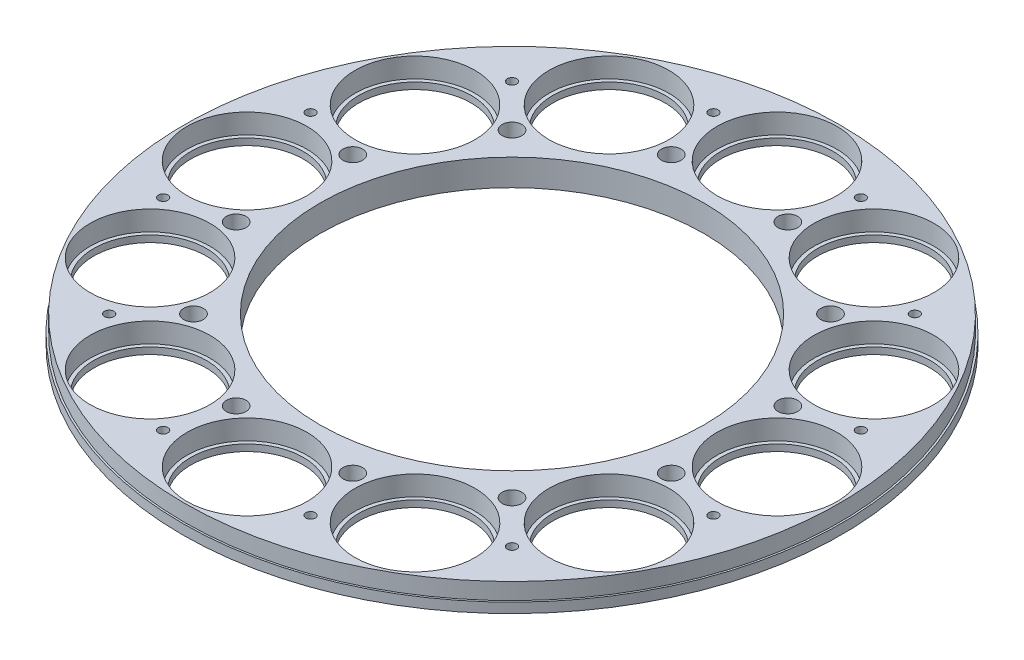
SolidWorks part; units mm, degrees
ref_plane "Front" through (0, 0, 0) normal (0, 0, 1) x (1, 0, 0)
ref_plane "Top" through (0, 0, 0) normal (0, 1, 0) x (1, 0, 0)
ref_plane "Right" through (0, 0, 0) normal (1, 0, 0) x (0, 0, -1)
ref_axis "Axis1" through (0, 50, 0) along (0, -1, 0)
sketch "Sketch1" plane through (0, 0, 0) normal (0, 1, 0) x (1, 0, 0)
  circle A0 centre (0, 0) radius 157.9562
  dimension "D1" = 315.9125
extrude "Boss-Extrude1" add sketch "Sketch1" along normal blind 12.7
sketch "Sketch2" plane through (0, 12.7, 0) normal (0, 1, 0) x (1, 0, 0)
  circle A0 centre (0, 127) radius 28.7655
  dimension "D2" = 57.531
  dimension "D1" = 127
extrude "Cut-Extrude1" cut sketch "Sketch2" against normal offset from surface (9.525 mm away) 3.175
sketch "Sketch3" plane through (0, 3.175, 0) normal (0, 1, 0) x (1, 0, 0)
  circle A0 centre (0, 127) radius 26.9875
  circle A2 centre (0, 127) radius 28.7655 construction
  circle A3 centre (0, 127) radius 28.7655 construction
  dimension "D1" = 1.778
  dimension "D2" = 53.975
extrude "Cut-Extrude2" cut sketch "Sketch3" against normal through all
pattern_circular "CirPattern1" count 12 over 360 about axis through (0, 0, 0) along (0, 1, 0) of "Cut-Extrude1", "Cut-Extrude2"
sketch "Sketch4" plane through (0, 12.7, 0) normal (0, 1, 0) x (1, 0, 0)
  line L0 (0, 92.075) -> (0, 0) construction
  line L1 (0, 92.075) -> (0, 98.2345) construction
  circle A0 centre (0, 0) radius 92.075
  circle A3 centre (0, 127) radius 28.7655 construction
  dimension "D1" = 184.15
extrude "Cut-Extrude3" cut sketch "Sketch4" against normal through all
sketch "Sketch5" plane through (0, 0, 0) normal (0, 0, 1) x (1, 0, 0)
  line L1 (157.9562, 12.7) -> (157.0673, 12.7)
  line L2 (157.9562, 12.7) -> (157.9562, 4.7625)
  line L3 (157.9562, 4.7625) -> (157.0673, 4.7625)
  line L4 (157.0673, 12.7) -> (157.0673, 4.7625)
  dimension "D1" = 0.889
  dimension "D2" = 7.9375
revolve "Cut-Revolve1" cut sketch "Sketch5" angle 360 about axis through (0, 50, 0) along (0, -1, 0)
hole_wizard "CSK for M4 Flat Head Machine Screw1" positions "Sketch8" profile "Sketch9" countersink size "M4" standard "ANSI Metric"
sketch "Sketch8" plane through (0, 12.7, 0) normal (0, 1, 0) x (1, 0, 0)
  line L0 (0, 0) -> (0, 92.075) construction
  line L3 (27.9395, 104.2717) -> (0, 0) construction
  circle A0 centre (0, 0) radius 92.075 construction
  point P0 (27.9395, 104.2717)
  dimension "D1" = 15
  dimension "D2" = 107.95
sketch "Sketch9" plane through (27.9395, 12.7, -104.2717) normal (1, 0, 0) x (0, 0, 1)
  line L0 (0, 0) -> (0, 12.7)
  line L1 (0, 12.7) -> (2.25, 12.7)
  line L2 (2.25, 12.7) -> (2.25, 10.45)
  line L3 (2.25, 10.45) -> (4.7, 8)
  line L4 (4.7, 8) -> (4.7, 0)
  line L6 (4.7, 0) -> (0, 0)
  line L7 (-2.25, 10.45) -> (-4.7, 8) construction
  line L11 (0, -6.35) -> (0, 107.95) construction
  dimension "Thru Hole Dia." = 4.5
  dimension "Thru Hole Depth" = 12.7
  dimension "C'Sink Dia." = 9.4
  dimension "C'Sink Angle" = 90
  dimension "Head Clearance" = 8
pattern_circular "CirPattern2" count 12 over 360 about axis through (0, 0, 0) along (0, 1, 0) of "CSK for M4 Flat Head Machine Screw1"
sketch "Sketch11" plane through (0, 0, 0) normal (0, 1, 0) x (1, 0, 0)
  line L0 (44.9013, 71.842) -> (66.8214, 73.6797)
  line L1 (73.6797, 66.8214) -> (71.842, 44.9013)
  line L2 (71.842, 44.9013) -> (44.9013, 71.842)
  line L3 (0, 0) -> (58.3717, 58.3717) construction
  line L4 (0, 0) -> (0, 82.55) construction
  arc A0 (66.8214, 73.6797) -> (73.6797, 66.8214) centre (67.3519, 67.3519) cw
  dimension "D1" = 6.35
  dimension "D2" = 45
  dimension "D3" = 95.25
  dimension "D4" = 12.7
  dimension "D5" = 38.1
extrude "Cut-Extrude4" [suppressed] cut sketch "Sketch11" along normal through all
fillet "Fillet1" [suppressed] radius 3.175
pattern_circular "CirPattern3" [suppressed] count 12 over 360
sketch "Sketch12" plane through (0, 0, 0) normal (0, 1, 0) x (1, 0, 0)
  line L0 (0, 0) -> (35.3353, 131.873) construction
  line L2 (0, 136.525) -> (0, 0) construction
  circle A0 centre (35.3353, 131.873) radius 1.27
  dimension "D2" = 2.54
  dimension "D1" = 136.525
  dimension "D3" = 15
extrude "Cut-Extrude5" cut sketch "Sketch12" along normal through all
hole_wizard "CBORE for M4 SHCS2" positions "Sketch15" profile "Sketch16" counterbore size "M4" standard "ANSI Metric"
sketch "Sketch15" plane through (0, 0, 0) normal (0, -1, 0) x (-1, 0, 0)
  point P6 (-35.3353, 131.873)
sketch "Sketch16" plane through (35.3353, 0, -131.873) normal (1, 0, 0) x (0, 0, -1)
  line L0 (0, 0) -> (0, 12.7)
  line L1 (0, 12.7) -> (2.25, 12.7)
  line L3 (2.25, 12.7) -> (2.25, 6)
  line L4 (2.25, 6) -> (5.715, 6)
  line L5 (5.715, 6) -> (5.715, 0)
  line L7 (5.715, 0) -> (0, 0)
  line L11 (0, -6.35) -> (0, 107.95) construction
  dimension "Thru Hole Dia." = 4.5
  dimension "Thru Hole Depth" = 12.7
  dimension "C'Bore Dia." = 11.43
  dimension "C'Bore Depth" = 6
sketch "Sketch17" plane through (0, 0, 0) normal (0, -1, 0) x (1, 0, 0)
  line L0 (35.3353, -131.873) -> (32.0483, -119.6058) construction
  line L1 (33.1619, -132.4554) -> (29.8749, -120.1881)
  line L2 (37.5086, -131.2907) -> (34.2216, -119.0234)
  arc A0 (33.1619, -132.4554) -> (37.5086, -131.2907) centre (35.3353, -131.873) ccw
  arc A1 (34.2216, -119.0234) -> (29.8749, -120.1881) centre (32.0483, -119.6058) ccw
  circle A3 centre (35.3353, -131.873) radius 2.25 construction
  point P3 (33.6918, -125.7394)
  dimension "D1" = 12.7
extrude "Cut-Extrude6" cut sketch "Sketch17" against normal up to surface (6 mm away)
pattern_circular "CirPattern4" count 12 over 360 about axis through (0, 0, 0) along (0, 1, 0) of "Cut-Extrude5", "CBORE for M4 SHCS2", "Cut-Extrude6"
ref_plane "Plane1" through (0, 0, 0) normal (-0.9659, 0, 0.2588) x (0, -1, 0)
sketch "Sketch18" plane through (0, 0, 0) normal (0, -1, 0) x (1, 0, 0)
  line L0 (0, 0) -> (-150.0847, -26.464) construction
  line L1 (0, 0) -> (-131.873, -35.3353) construction
  line L2 (0, 0) -> (-143.2092, 52.1239) construction
  line L3 (0, 0) -> (-97.9608, 116.7452) construction
  line L4 (0, 0) -> (-26.464, 150.0847) construction
  line L5 (0, 0) -> (52.1239, 143.2092) construction
  line L6 (0, 0) -> (116.7452, 97.9608) construction
  line L7 (0, 0) -> (150.0847, 26.464) construction
  line L8 (0, 0) -> (143.2092, -52.1239) construction
  line L9 (0, 0) -> (97.9608, -116.7452) construction
  line L10 (0, 0) -> (26.464, -150.0847) construction
  line L11 (0, 0) -> (-52.1239, -143.2092) construction
  line L12 (0, 0) -> (-116.7452, -97.9608) construction
  circle A2 centre (-131.873, -35.3353) radius 2.25 construction
  text T0 "<b>1</b>" font "Century Gothic" height 6.35
  text T1 "<b>2</b>" font "Century Gothic" height 6.35
  text T2 "<b>3</b>" font "Century Gothic" height 6.35
  text T3 "<b>4</b>" font "Century Gothic" height 6.35
  text T4 "<b>5</b>" font "Century Gothic" height 6.35
  text T5 "<b>6</b>" font "Century Gothic" height 6.35
  text T6 "<b>7</b>" font "Century Gothic" height 6.35
  text T7 "<b>8</b>" font "Century Gothic" height 6.35
  text T8 "<b>9</b>" font "Century Gothic" height 6.35
  text T9 "<b>10</b>" font "Century Gothic" height 6.35
  text T10 "<b>11</b>" font "Century Gothic" height 6.35
  text T11 "<b>12</b>" font "Century Gothic" height 6.35
  point P19 (0, 0)
  dimension "D1" = 5
  dimension "D2" = 152.4
  dimension "D3" = 12
extrude "Cut-Extrude7" cut sketch "Sketch18" against normal blind 1.27
